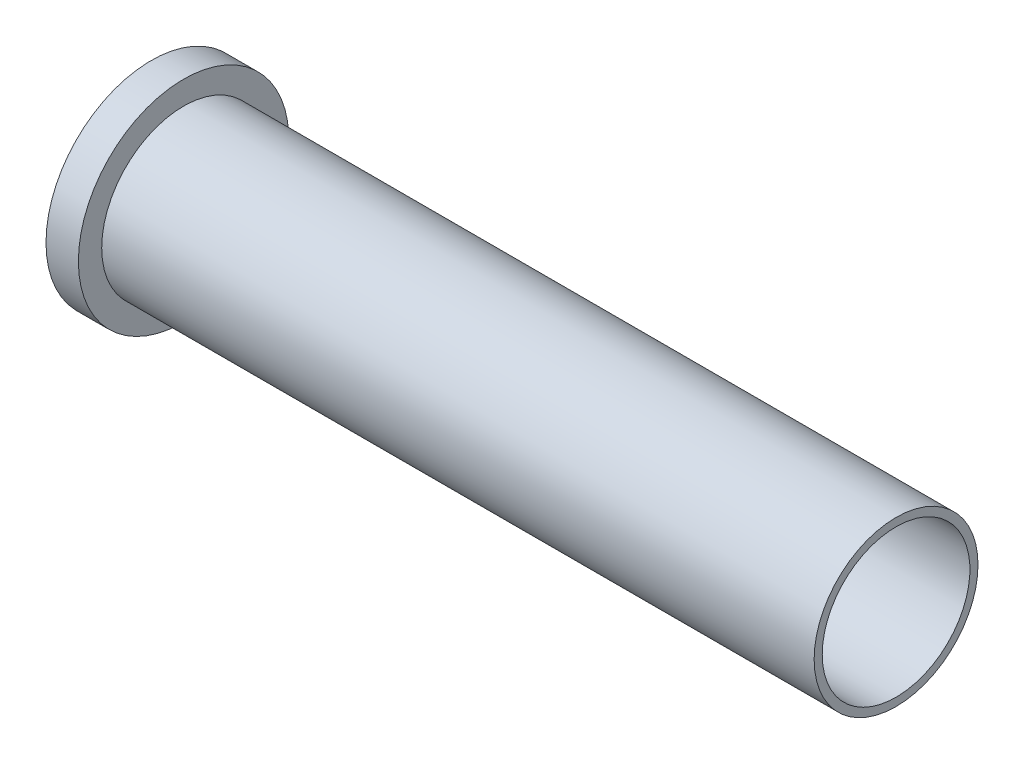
SolidWorks part; units mm, degrees
ref_plane "Front Plane" through (0, 0, 0) normal (0, 0, 1) x (1, 0, 0)
ref_plane "Top Plane" through (0, 0, 0) normal (0, 1, 0) x (1, 0, 0)
ref_plane "Right Plane" through (0, 0, 0) normal (1, 0, 0) x (0, 0, -1)
sketch "Sketch1" plane through (0, 0, 0) normal (1, 0, 0) x (0, 0, -1)
  circle A0 centre (0, 0) radius 16.0655
  dimension "D1" = 32.131
extrude "Extrude1" add sketch "Sketch1" along normal blind 139.7
sketch "Sketch2" plane through (0, 0, 0) normal (-1, 0, 0) x (0, 0, 1)
  circle A0 centre (0, 0) radius 20.6375
  dimension "D1" = 41.275
extrude "Extrude2" add sketch "Sketch2" along normal blind 6.35
sketch "Sketch3" plane through (-6.35, 0, 0) normal (-1, 0, 0) x (0, 0, 1)
  circle A0 centre (0, 0) radius 14.478
  dimension "D1" = 28.956
extrude "Cut-Extrude1" cut sketch "Sketch3" against normal through all
